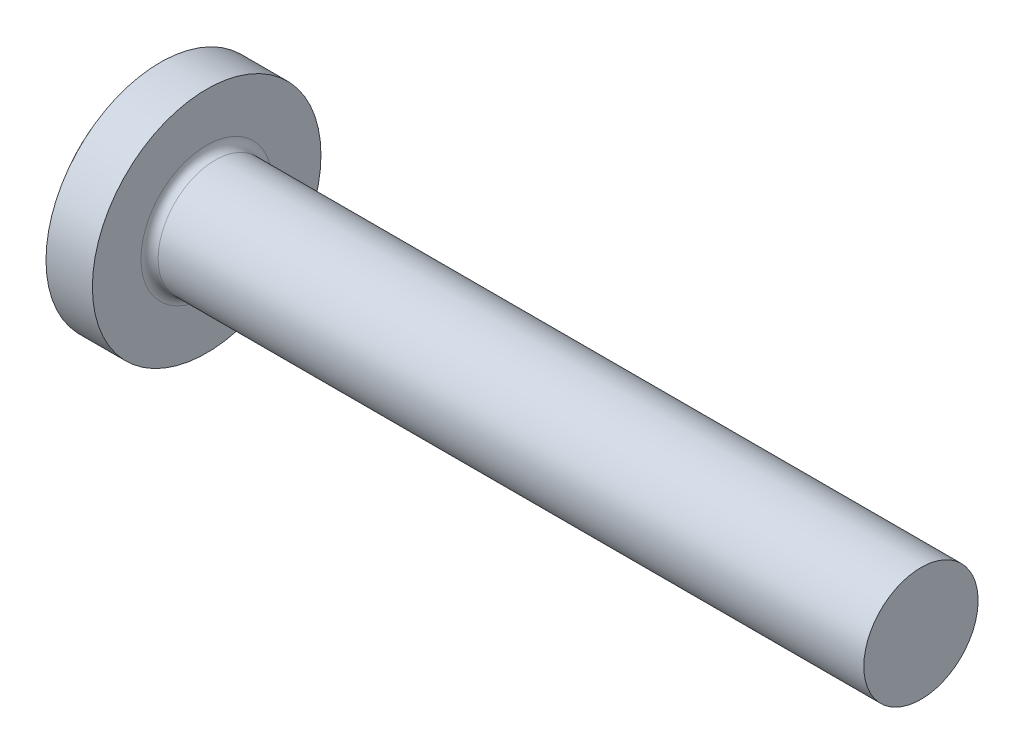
SolidWorks part; units mm, degrees
ref_plane "Front Plane" through (0, 0, 0) normal (0, 0, 1) x (1, 0, 0)
ref_plane "Top Plane" through (0, 0, 0) normal (0, 1, 0) x (1, 0, 0)
ref_plane "Right Plane" through (0, 0, 0) normal (1, 0, 0) x (0, 0, -1)
sketch "BodySke" plane through (0, 0, 0) normal (0, 0, 1) x (1, 0, 0)
  line L0 (0, 0) -> (111.3824, 0) construction
  line L1 (0, 0) -> (0, 8) construction
  line L2 (6, 4) -> (6, 8)
  line L3 (6, 8) -> (2.753, 8)
  line L4 (6, 4) -> (56, 4)
  line L5 (56, 4) -> (56, 0)
  line L6 (7.25, 7.824) -> (7.25, -6.8939) construction
  line L7 (0, 0) -> (56, 0)
  line L8 (8.5, 8.824) -> (8.5, -4.958) construction
  arc A1 (2.753, 8) -> (0, 0) centre (13, 0) ccw
  point P10 (56, 3.4455)
  dimension "Head_radius" = 13
  dimension "Diameter" = 8
  dimension "Head_dia" = 16
  dimension "Head_height" = 6
  dimension "Length" = 50
  dimension "Advance" = 1.25
  dimension "Thread_minor" = 6.891
  dimension "Thread_runout" = 2.5
revolve "BaseBody" add sketch "BodySke" angle 360 about L0
fillet "Fillet1" radius 0.6 1 edges at (6, 0, 4)
ref_plane "Plane1" through (4.5, 0, 0) normal (1, 0, 0) x (0, 0, -1)
sketch "RecSkeTop" plane through (0, 0, 0) normal (1, 0, 0) x (0, 0, -1)
  line L1 (-0.968, 4.4) -> (0.968, 4.4)
  line L2 (-0.968, 4.4) -> (-0.968, -4.4)
  line L3 (-0.968, -4.4) -> (0.968, -4.4)
  line L4 (0.968, 4.4) -> (0.968, -4.4)
  dimension "D1" = 4.4
  dimension "Cross_dia" = 8.8
  dimension "D2" = 1.936
  dimension "D3" = 0.968
sketch "RecSkeBot" plane through (4.5, 0, 0) normal (1, 0, 0) x (0, 0, -1)
  line L0 (-0.968, 4.4) -> (-0.968, -4.4) construction
  line L1 (-0.968, 2.1564) -> (0.968, 2.1564)
  line L2 (-0.968, 2.1564) -> (-0.968, -2.1564)
  line L3 (-0.968, -2.1564) -> (0.968, -2.1564)
  line L4 (0.968, 2.1564) -> (0.968, -2.1564)
  line L5 (0.968, 4.4) -> (0.968, -4.4) construction
  dimension "D1" = 4.3128
  dimension "D2" = 2.1564
loft "Recess" cut profiles "RecSkeTop", "RecSkeBot"
pattern_circular "RecPat" count 2 every 90 about axis through (0, 0, 0) along (1, 0, 0) of "Recess"
sketch "RecCorSke" plane through (0, 0, 0) normal (0, 0, 1) x (1, 0, 0)
  line L0 (0, 0) -> (57.5987, 0) construction
  line L1 (0, 0) -> (0, 2.1296)
  line L3 (0, 2.1296) -> (4.5, 1.8149)
  line L4 (4.5, 1.8149) -> (5.0897, 0)
  line L5 (5.0897, 0) -> (0, 0)
  dimension "D1" = 18
  dimension "D2" = 4.5
  dimension "D3" = 2.1296
  dimension "D4" = 4
revolve "RecessCore" cut sketch "RecCorSke" angle 360 about L0
sketch "ThdSchSke" plane through (0, 0, 0) normal (0, 0, 1) x (1, 0, 0)
  line L0 (0, 0) -> (55.1256, 0) construction
  line L1 (0, 0) -> (111.3824, 0) construction
  line L2 (55.6799, 4) -> (55.6799, 4.6403)
  line L3 (55.6799, 4.6403) -> (56.3201, 4.6403)
  line L4 (56.3201, 4.6403) -> (56.3201, 4)
  line L5 (56.3201, 4) -> (56, 3.4455)
  line L6 (56, 3.4455) -> (55.6799, 4)
  line L7 (6, 4) -> (56, 4) construction
  line L13 (56, 4) -> (56, 0) construction
revolve "ThreadSchematic" [suppressed] cut sketch "ThdSchSke" angle 360 about L0
pattern_linear "ThdSchPat" [suppressed] count 39 along (1, 0, 0)
equation "\"Thread_minor@ThreadCosmetic\" = \"Thread_minor@BodySke\""
equation "\"D1@RecSkeTop\" = \"Cross_dia@RecSkeTop\" / 2"
equation "\"D2@RecSkeTop\" = \"Cross_dia@RecSkeTop\" * 0.22"
equation "\"D3@RecSkeTop\" = \"D2@RecSkeTop\" / 2"
equation "\"D1@RecSkeBot\" = \"Cross_dia@RecSkeTop\" - 2 * \"Cross_depth@Plane1\" *  tan( 26.5 * 0.017453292 ) "
equation "\"D2@RecSkeBot\" = \"D1@RecSkeBot\" / 2"
equation "\"D2@RecCorSke\" = \"Cross_depth@Plane1\""
equation "\"D3@RecCorSke\" = \"D2@RecSkeTop\" * 1.1"
equation "\"Advance@ThdSchPat\" = \"Advance@BodySke\""
equation "\"D1@ThdSchPat\" =  int( ( \"Length@BodySke\"-\"Thread_runout@BodySke\" )  / \"Advance@ThdSchPat\" ) + 1 "
